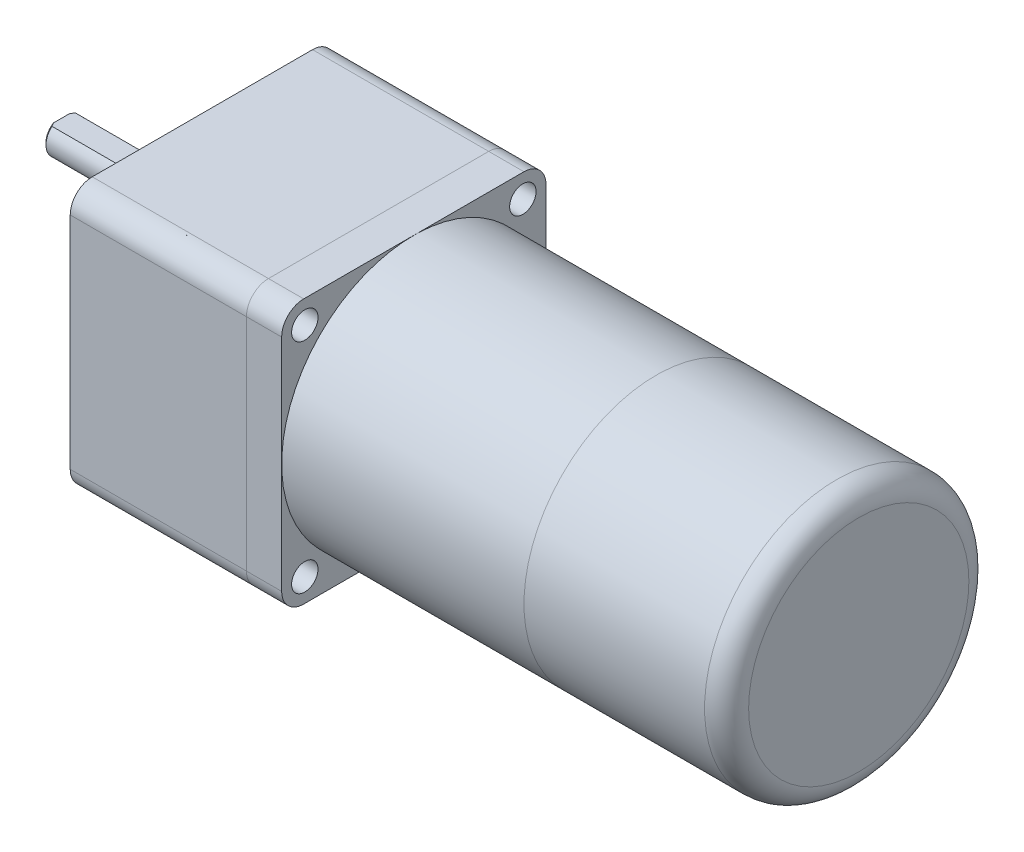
SolidWorks part; units mm, degrees
ref_plane "前视基准面" through (0, 0, 0) normal (0, 0, 1) x (1, 0, 0)
ref_plane "上视基准面" through (0, 0, 0) normal (0, 1, 0) x (1, 0, 0)
ref_plane "右视基准面" through (0, 0, 0) normal (1, 0, 0) x (0, 0, -1)
sketch "草图1" plane through (0, 0, 0) normal (1, 0, 0) x (0, 0, -1)
  line L1 (-25, -30) -> (25, -30)
  line L2 (-30, -25) -> (-30, 25)
  line L3 (-25, 30) -> (25, 30)
  line L4 (30, -25) -> (30, 25)
  line L5 (-30, -30) -> (30, 30) construction
  line L6 (-30, 30) -> (30, -30) construction
  arc A0 (-25, -30) -> (-30, -25) centre (-25, -25) cw
  arc A1 (-30, 25) -> (-25, 30) centre (-25, 25) cw
  arc A2 (25, 30) -> (30, 25) centre (25, 25) cw
  arc A3 (25, -30) -> (30, -25) centre (25, -25) ccw
  point P0 (0, 0)
  dimension "D1" = 5
extrude "凸台-拉伸1" add sketch "草图1" along normal blind 40
sketch "草图2" plane through (40, 0, 0) normal (1, 0, 0) x (0, 0, -1)
  line L0 (25, 30) -> (-25, 30) construction
  line L1 (-25, -30) -> (25, -30)
  line L2 (-30, -25) -> (-30, 25)
  line L3 (-25, 30) -> (25, 30)
  line L4 (30, -25) -> (30, 25)
  line L5 (-30, -30) -> (30, 30) construction
  line L6 (-30, 30) -> (30, -30) construction
  arc A0 (-25, -30) -> (-30, -25) centre (-25, -25) cw
  arc A1 (25, -30) -> (30, -25) centre (25, -25) ccw
  arc A2 (25, 30) -> (30, 25) centre (25, 25) cw
  arc A3 (-30, 25) -> (-25, 30) centre (-25, 25) cw
  point P0 (0, 0)
  dimension "D1" = 5
extrude "凸台-拉伸2" add sketch "草图2" along normal blind 8 separate body
sketch "草图3" plane through (48, 0, 0) normal (1, 0, 0) x (0, 0, -1)
  circle A0 centre (0, 0) radius 30
extrude "凸台-拉伸3" add sketch "草图3" along normal blind 55 separate body
sketch "草图4" plane through (103, 0, 0) normal (1, 0, 0) x (0, 0, -1)
  circle A0 centre (0, 0) radius 30
extrude "凸台-拉伸4" add sketch "草图4" along normal blind 46 separate body
fillet "圆角1" radius 5 1 edges at (149, 0, -30)
sketch "草图5" plane through (0, 0, 0) normal (-1, 0, 0) x (0, 0, 1)
  point P19 (-24.7487, 24.7487)
  point P20 (24.7487, 24.7487)
  point P21 (24.7487, -24.7487)
  point P22 (-24.7487, -24.7487)
hole_wizard "M4 螺纹孔1" positions "3D草图1" profile "草图6" tap size "M4" standard "GB"
sketch3d "3D草图1"
  point P0 (0, 24.7487, -24.7487)
  point P3 (0, 24.7487, 24.7487)
  point P6 (0, -24.7487, 24.7487)
  point P9 (0, -24.7487, -24.7487)
sketch "草图6" plane through (0, 24.7487, -24.7487) normal (0, 1, 0) x (0, 0, 1)
  line L0 (0, 0) -> (0, 12.4914)
  line L1 (0, 12.4914) -> (1.65, 11.5)
  line L2 (1.65, 11.5) -> (1.65, 0)
  line L5 (1.65, 0) -> (0, 0)
  line L10 (0, 12.4914) -> (-1.65, 11.5) construction
  line L11 (0, -6.35) -> (0, 107.95) construction
  dimension "螺纹孔钻头直径" = 3.3
  dimension "螺纹孔钻头深度" = 11.5
  dimension "导头角度" = 118
sketch "草图7" plane through (48, 0, 0) normal (1, 0, 0) x (0, 0, -1)
  circle A1 centre (-24.7487, 24.7487) radius 3
  circle A2 centre (24.7487, 24.7487) radius 3
  circle A3 centre (24.7487, -24.7487) radius 3
  circle A4 centre (-24.7487, -24.7487) radius 3
extrude "切除-拉伸1" cut sketch "草图7" against normal blind 36.5
fillet "圆角2" radius 0.5 4 edges at (0, -24.7487, -23.0987) (0, -24.7487, 26.3987) (0, 24.7487, 26.3987) (0, 24.7487, -23.0987)
sketch "草图8" plane through (0, 0, 0) normal (-1, 0, 0) x (0, 0, 1)
  circle A0 centre (0, 10) radius 12
extrude "凸台-拉伸5" add sketch "草图8" along normal blind 3.3 separate body
fillet "圆角3" radius 0.5 1 edges at (-3.3, 10, 12)
sketch "草图9" plane through (-3.3, 0, 0) normal (-1, 0, 0) x (0, 0, 1)
  circle A0 centre (0, 10) radius 4
extrude "凸台-拉伸6" add sketch "草图9" along normal blind 28.7 separate body
sketch "草图10" plane through (-32, 0, 0) normal (-1, 0, 0) x (0, 0, 1)
  line L2 (2.6458, 13) -> (-2.6458, 13)
  circle A0 centre (0, 10) radius 4 construction
  arc A1 (2.6458, 13) -> (-2.6458, 13) centre (0, 10) ccw
extrude "切除-拉伸2" cut sketch "草图10" against normal blind 25
chamfer "倒角1" distance 0.5 angle 45 1 edges at (-32, 6, 0)
sketch "草图11" plane through (0, 0, 0) normal (-1, 0, 0) x (0, 0, 1)
  circle A0 centre (0, 0) radius 26.3
extrude "切除-拉伸3" cut sketch "草图11" against normal blind 0.5
fillet "圆角4" radius 0.5 1 edges at (0, 0, 26.3)
